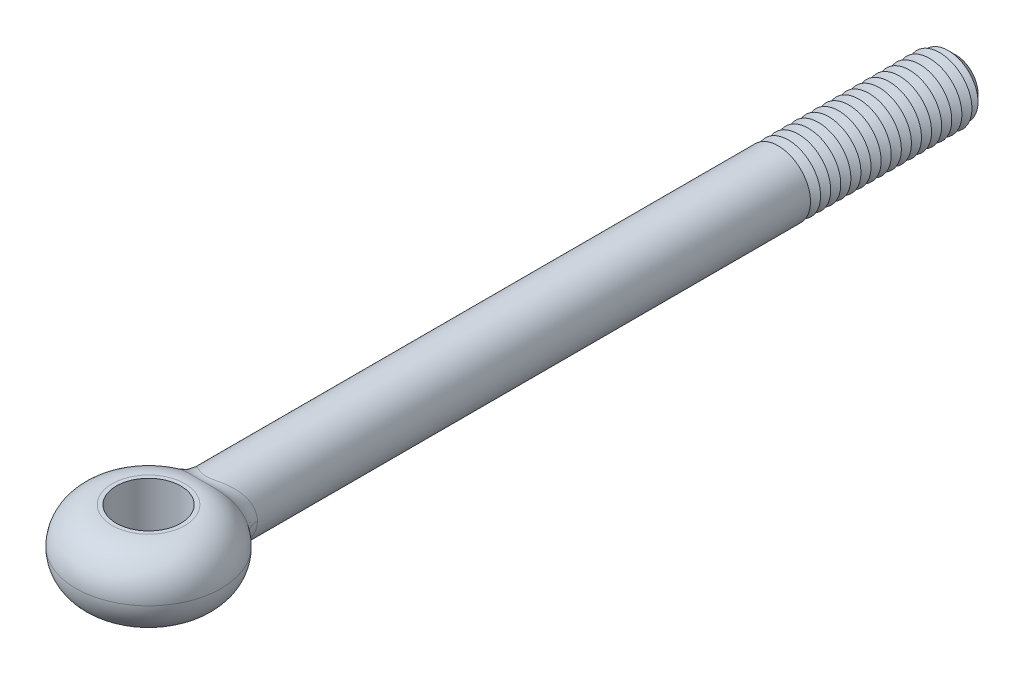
SolidWorks part; units mm, degrees
ref_plane "Front Plane" through (0, 0, 0) normal (0, 0, 1) x (1, 0, 0)
ref_plane "Top Plane" through (0, 0, 0) normal (0, 1, 0) x (1, 0, 0)
ref_plane "Right Plane" through (0, 0, 0) normal (1, 0, 0) x (0, 0, -1)
sketch "Sketch7" plane through (0, 0, 0) normal (0, 1, 0) x (1, 0, 0)
  circle A0 centre (0, 0) radius 9
  dimension "D1" = 18
extrude "Boss-Extrude3" add sketch "Sketch7" along normal mid plane 9
sketch "Sketch8" plane through (0, 0, 0) normal (0, 0, 1) x (1, 0, 0)
  circle A0 centre (0, 0) radius 4
  dimension "D1" = 8
extrude "Boss-Extrude4" add sketch "Sketch8" against normal blind 100
fillet "Fillet5" radius 4.5 2 edges at (0, -4.5, 9) (0, 4.5, 9)
fillet "Fillet6" radius 2.5 2 edges at (0.3214, -3.9871, -6.5786) (-0.3214, 3.9871, -6.5786)
chamfer "Chamfer1" distance 1.25 angle 45 1 edges at (4, 0, -100)
sketch "Sketch10" plane through (0, 0, 0) normal (0, 1, 0) x (1, 0, 0)
  line L0 (0, 28.1405) -> (0, -7.9233) construction
sketch "Sketch11" plane through (0, 0, 0) normal (0, 1, 0) x (1, 0, 0)
  line L0 (-4, 78) -> (-2.9175, 78.625)
  line L1 (-4, 98.75) -> (-4, 9.4868) construction
  line L2 (-2.9175, 78.625) -> (-4, 79.25)
  line L3 (-4, 79.25) -> (-4, 78)
  line L4 (2.75, 100) -> (-2.75, 100) construction
  dimension "D1" = 1.25
  dimension "D2" = 22
revolve "Cut-Revolve1" cut sketch "Sketch11" angle 360 about L0
pattern_linear "LPattern1" count 17 spacing 1.25 along (0, 0, -1) of "Cut-Revolve1"
sketch "Sketch12" plane through (0, 0, 0) normal (0, 1, 0) x (1, 0, 0)
  circle A0 centre (0, 0) radius 4
  dimension "D1" = 8
extrude "Cut-Extrude1" cut sketch "Sketch12" against normal mid plane 9
